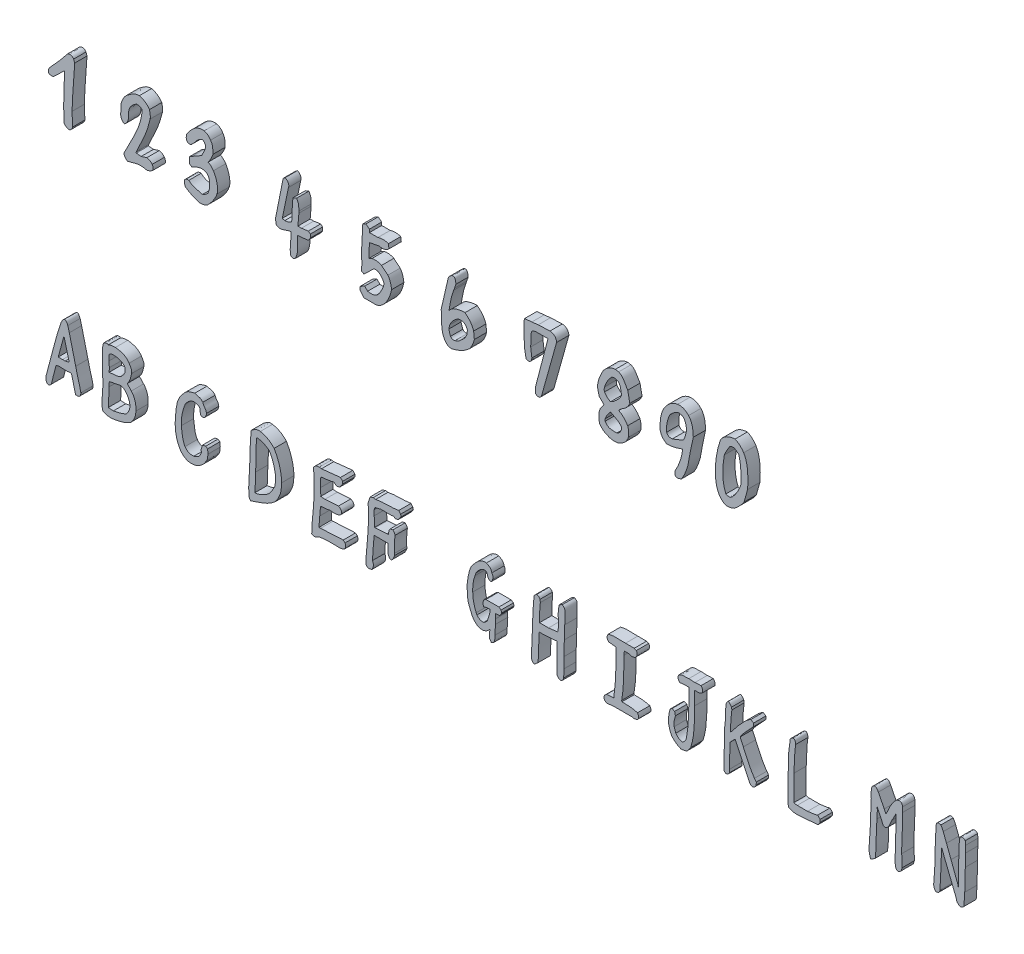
SolidWorks part; units mm, degrees
ref_plane "正面" through (0, 0, 0) normal (0, 0, 1) x (1, 0, 0)
ref_plane "平面" through (0, 0, 0) normal (0, 1, 0) x (1, 0, 0)
ref_plane "右側面" through (0, 0, 0) normal (1, 0, 0) x (0, 0, -1)
sketch "ｽｹｯﾁ1" plane through (0, 0, 0) normal (0, 0, 1) x (1, 0, 0)
  text T0 "1    2   3      4     5     6     7    8   9  0      A  B    C    D   E  F       G   H    I   J  K   L     M   N" font "みかちゃん-PB" height 10
extrude "ﾎﾞｽ - 押し出し1" add sketch "ｽｹｯﾁ1" along normal blind 2
